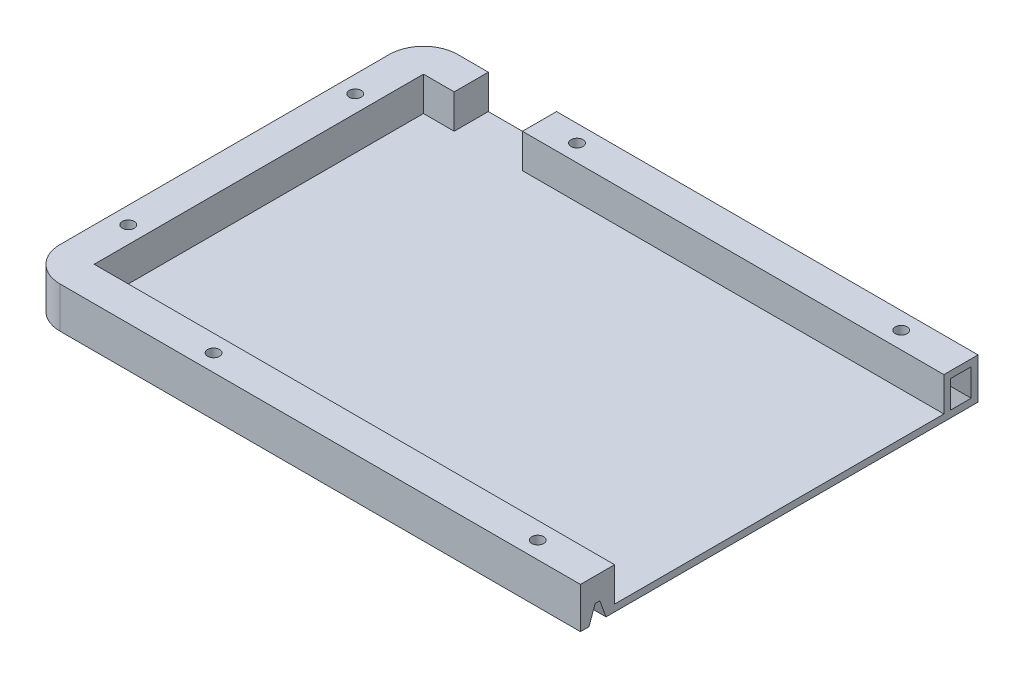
SolidWorks part; units mm, degrees
ref_plane "Front Plane" through (0, 0, 0) normal (0, 0, 1) x (1, 0, 0)
ref_plane "Top Plane" through (0, 0, 0) normal (0, 1, 0) x (1, 0, 0)
ref_plane "Right Plane" through (0, 0, 0) normal (1, 0, 0) x (0, 0, -1)
sketch "Sketch1" plane through (0, 0, 0) normal (0, 1, 0) x (1, 0, 0)
  line L1 (0, 0) -> (162.5, 0)
  line L2 (0, 0) -> (0, 116.5)
  line L3 (0, 116.5) -> (162.5, 116.5)
  line L4 (162.5, 0) -> (162.5, 116.5)
  dimension "D1" = 116.5
  dimension "D2" = 162.5
extrude "Boss-Extrude1" add sketch "Sketch1" along normal blind 2
sketch "Sketch2" plane through (0, 2, 0) normal (0, 1, 0) x (1, 0, 0)
  line L3 (162.5, 111.5) -> (39, 111.5)
  line L4 (5, 111.5) -> (5, 5)
  line L5 (5, 5) -> (162.5, 5)
  line L7 (0, 116.5) -> (0, 0) construction
  line L8 (162.5, 116.5) -> (0, 116.5) construction
  line L10 (162.5, 0) -> (162.5, 116.5) construction
  line L11 (0, 0) -> (162.5, 0) construction
  line L12 (0, 116.5) -> (39, 116.5) construction
  line L13 (39, 116.5) -> (39, 106.1994) construction
  line L14 (19, 116.5) -> (19, 106.1994) construction
  line L15 (19, 111.5) -> (5, 111.5)
  dimension "D1" = 5
  dimension "D2" = 5
  dimension "D3" = 5
  dimension "D4" = 39
  dimension "D5" = 20
  dimension "D6" = 10.3006
extrude "Extrude-Thin1" add sketch "Sketch2" along normal blind 10 thin
fillet "Fillet1" radius 10 2 edges at (0, 6, -116.5) (0, 6, 0)
sketch "Sketch3" plane through (162.5, 0, 0) normal (1, 0, 0) x (0, 0, -1)
  line L0 (10, 12) -> (0, 12) construction
  line L5 (2, 10) -> (10, 10)
  line L6 (2, 10) -> (2, 2)
  line L7 (2, 2) -> (10, 2)
  line L8 (10, 10) -> (10, 2)
  line L9 (108.5, 10) -> (114.5, 10)
  line L10 (108.5, 10) -> (108.5, 2)
  line L11 (108.5, 2) -> (114.5, 2)
  line L12 (114.5, 10) -> (114.5, 2)
  line L13 (0, 12) -> (0, 0) construction
  line L14 (0, 0) -> (116.5, 0) construction
  line L15 (10, 12) -> (10, 2) construction
  line L16 (116.5, 12) -> (116.5, 0) construction
  line L17 (106.5, 12) -> (106.5, 2) construction
  dimension "D1" = 2
  dimension "D2" = 2
  dimension "D3" = 2
  dimension "D4" = 0
  dimension "D5" = 2
  dimension "D6" = 2
extrude "Cut-Extrude1" cut sketch "Sketch3" against normal blind 10 draft 45 contours L12 L9 L10 L11
sketch "Sketch4" plane through (0, 0, 0) normal (0, -1, 0) x (1, 0, 0)
  line L0 (0, -25) -> (5, -25) construction
  line L1 (0, -106.5) -> (0, -10) construction
  line L2 (5, 0) -> (5, -25) construction
  line L3 (10, 0) -> (162.5, 0) construction
  line L4 (50, 0) -> (50, -5) construction
  line L5 (0, -58.25) -> (58.1964, -58.25) construction
  circle A0 centre (5, -25) radius 3
  circle A1 centre (50, -5) radius 3
  circle A2 centre (145, -5) radius 3
  circle A3 centre (145, -111.5) radius 3
  circle A4 centre (50, -111.5) radius 3
  circle A5 centre (5, -91.5) radius 3
  dimension "D5" = 6
  dimension "D6" = 6
  dimension "D8" = 95
  dimension "D1" = 25
  dimension "D2" = 5
  dimension "D3" = 5
  dimension "D4" = 50
  dimension "D7" = 2
extrude "Cut-Extrude2" cut sketch "Sketch4" against normal blind 9
sketch "Sketch5" plane through (0, 9, 0) normal (0, -1, 0) x (1, 0, 0)
  circle A0 centre (145, -5) radius 3 construction
  circle A1 centre (145, -111.5) radius 3 construction
  circle A2 centre (50, -5) radius 3 construction
  circle A3 centre (5, -25) radius 3 construction
  circle A4 centre (5, -91.5) radius 3 construction
  circle A5 centre (50, -111.5) radius 3 construction
  circle A6 centre (5, -25) radius 1.75
  circle A7 centre (5, -91.5) radius 1.75
  circle A8 centre (50, -111.5) radius 1.75
  circle A9 centre (145, -111.5) radius 1.75
  circle A10 centre (145, -5) radius 1.75
  circle A11 centre (50, -5) radius 1.75
  dimension "D1" = 3.5
extrude "Cut-Extrude3" cut sketch "Sketch5" against normal through all
chamfer "Chamfer1" distance 0.75 6 edges at (5, 9, -28) (5, 9, -88.5) (50, 9, -108.5) (145, 9, -108.5) (145, 9, -8) (50, 9, -8)
sketch "Sketch6" plane through (0, 0, 0) normal (0, -1, 0) x (1, 0, 0)
  line L0 (162.5, -116.5) -> (10, -116.5) construction
  line L1 (162.5, 0) -> (162.5, -116.5) construction
  line L3 (87.5, -114) -> (137.5, -114)
  line L4 (87.5, -114) -> (87.5, -109)
  line L5 (87.5, -109) -> (137.5, -109)
  line L6 (137.5, -114) -> (137.5, -109)
  line L7 (87.5, -114) -> (137.5, -109) construction
  line L8 (87.5, -109) -> (137.5, -114) construction
  circle A0 centre (112.5, -111.5) radius 2.5 construction
  dimension "D3" = 5
  dimension "D1" = 5
  dimension "D2" = 50
  dimension "D4" = 50
extrude "Cut-Extrude4" cut sketch "Sketch6" against normal blind 5 draft 20
sketch "Sketch9" plane through (0, 0, 0) normal (0, -1, 0) x (1, 0, 0)
  line L0 (162.5, 0) -> (162.5, -116.5) construction
  line L1 (162.5, -2.5) -> (150, -2.5)
  line L2 (162.5, -2.5) -> (162.5, -7.5)
  line L3 (162.5, -7.5) -> (150, -7.5)
  line L4 (150, -2.5) -> (150, -7.5)
  line L5 (10, 0) -> (162.5, 0) construction
  point P6 (150, -5)
  dimension "D1" = 12.5
  dimension "D2" = 5
  dimension "D3" = 5
extrude "Cut-Extrude6" cut sketch "Sketch9" against normal blind 5
draft "Draft1" type of draft neutral plane draft angle 20 faces to draft 3 parameters "D1"=20
